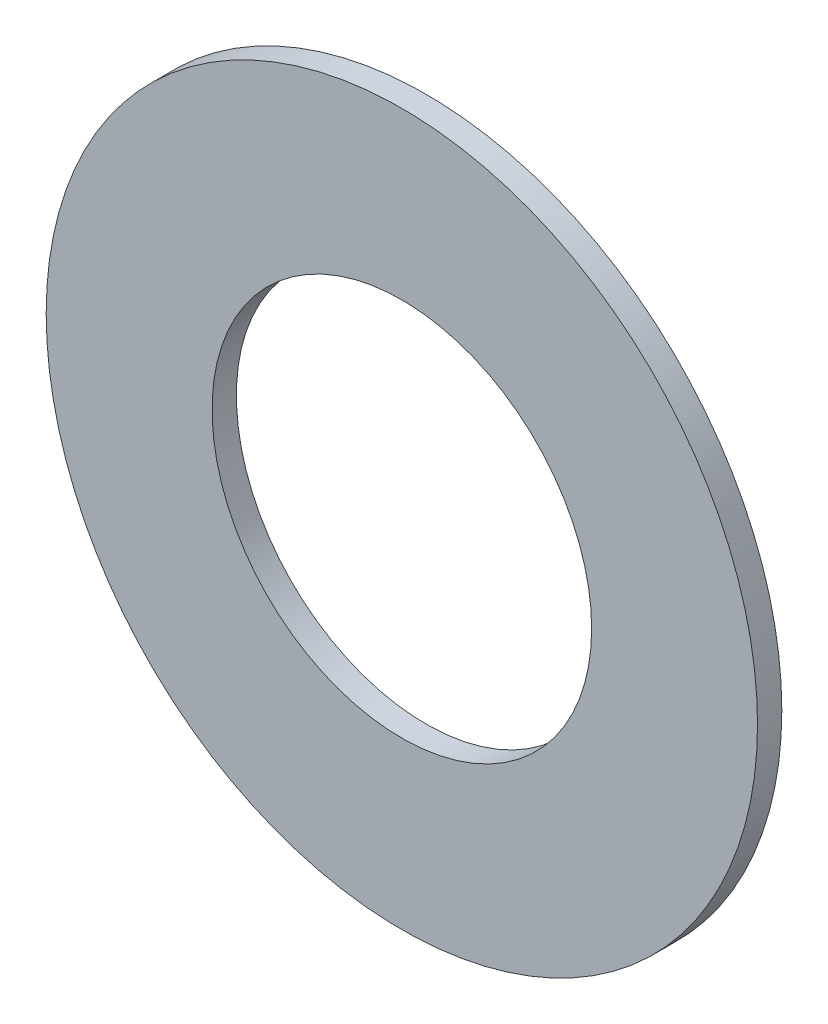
SolidWorks part; units mm, degrees
ref_plane "Front Plane" through (0, 0, 0) normal (0, 0, 1) x (1, 0, 0)
ref_plane "Top Plane" through (0, 0, 0) normal (0, 1, 0) x (1, 0, 0)
ref_plane "Right Plane" through (0, 0, 0) normal (1, 0, 0) x (0, 0, -1)
sketch "Sketch1" plane through (0, 0, 0) normal (0, 0, 1) x (1, 0, 0)
  circle A0 centre (0, 0) radius 11.8999
  circle A1 centre (0, 0) radius 6.35
  dimension "D1" = 12.7
  dimension "D2" = 23.7998
extrude "Extrude1" add sketch "Sketch1" along normal blind 0.8128
